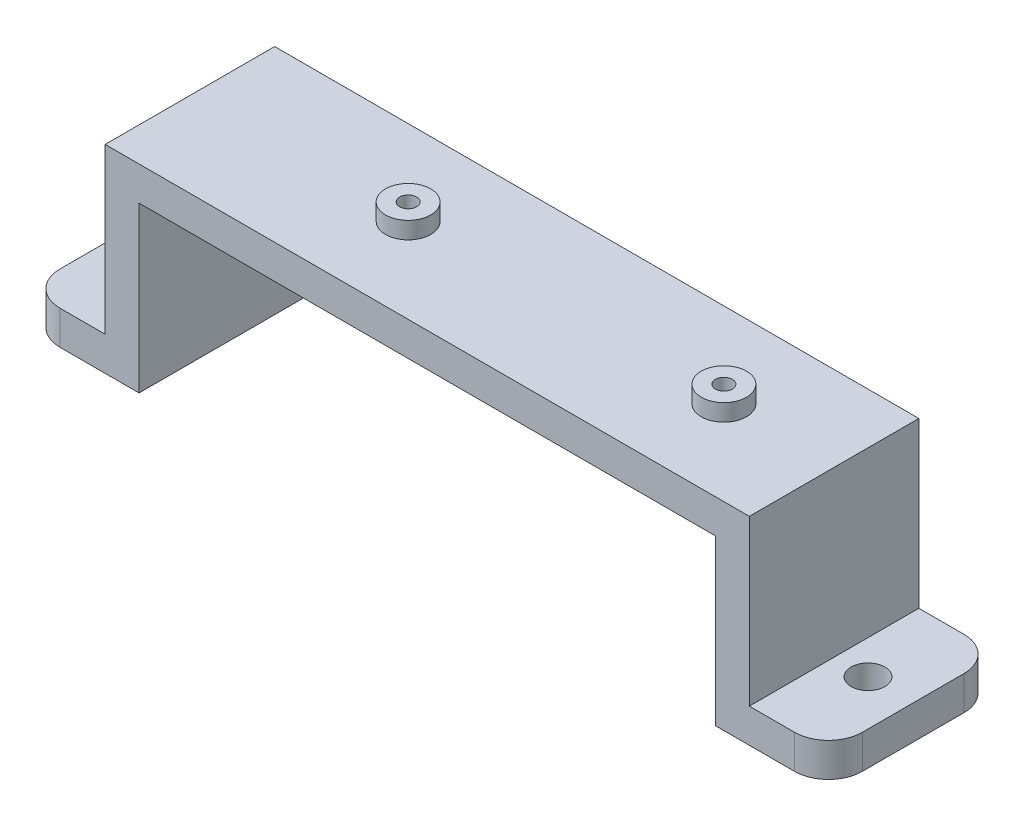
SolidWorks part; units mm, degrees
ref_plane "Plan de face" through (0, 0, 0) normal (0, 0, 1) x (1, 0, 0)
ref_plane "Plan de dessus" through (0, 0, 0) normal (0, 1, 0) x (1, 0, 0)
ref_plane "Plan de droite" through (0, 0, 0) normal (1, 0, 0) x (0, 0, -1)
sketch "Esquisse1" plane through (0, 0, 0) normal (0, 0, 1) x (1, 0, 0)
  line L0 (-35.5, 0) -> (-25.5, 0)
  line L1 (-25.5, 0) -> (-25.5, 14.5476)
  line L2 (-25.5, 14.5476) -> (25.5, 14.5476)
  line L3 (25.5, 14.5476) -> (25.5, 0)
  line L4 (25.5, 0) -> (35.5, 0)
  line L5 (0, 14.5476) -> (0, -4.7677) construction
  line L6 (-35.5, 3) -> (-28.5, 3)
  line L7 (-28.5, 3) -> (-28.5, 17.5476)
  line L8 (-28.5, 17.5476) -> (28.5, 17.5476)
  line L9 (28.5, 17.5476) -> (28.5, 3)
  line L10 (28.5, 3) -> (35.5, 3)
  line L11 (35.5, 3) -> (35.5, 0)
  line L12 (-35.5, 0) -> (-35.5, 3)
  dimension "D1" = 51
  dimension "D2" = 10
  dimension "D3" = 10
  dimension "D4" = 3
extrude "Extrusion1" add sketch "Esquisse1" along normal blind 15
sketch "Esquisse2" plane through (0, 17.5476, 0) normal (0, 1, 0) x (-1, 0, 0)
  line L0 (-28.5, 7.5) -> (28.5, 7.5) construction
  line L1 (-28.5, 15) -> (-28.5, 0) construction
  line L2 (28.5, 15) -> (28.5, 0) construction
  circle A0 centre (9.19, 7.5) radius 0.75
  circle A1 centre (-18.75, 7.5) radius 0.75
  dimension "D2" = 27.94
  dimension "D1" = 9.75
  dimension "D3" = 1.5
  dimension "D4" = 1.5
extrude "Enlèv. mat.-Extru.1" cut sketch "Esquisse2" against normal through all
fillet "Congé1" radius 3 4 edges at (35.5, 1.5, 0) (-35.5, 1.5, 0) (35.5, 1.5, 15) (-35.5, 1.5, 15)
sketch "Esquisse3" plane through (0, 0, 0) normal (0, -1, 0) x (1, 0, 0)
  line L0 (35.5, 7.5) -> (-35.5, 7.5) construction
  line L1 (35.5, 12) -> (35.5, 3) construction
  line L2 (-35.5, 12) -> (-35.5, 3) construction
  line L3 (0, 0) -> (0, 11.6453) construction
  circle A0 centre (31.5, 7.5) radius 1.5
  circle A1 centre (-31.5, 7.5) radius 1.5
  dimension "D1" = 4
extrude "Enlèv. mat.-Extru.2" cut sketch "Esquisse3" against normal through all
sketch "Esquisse4" plane through (0, 17.5476, 0) normal (0, 1, 0) x (-1, 0, 0)
  circle A0 centre (-18.75, 7.5) radius 0.75
  circle A1 centre (-18.75, 7.5) radius 2
  circle A2 centre (9.19, 7.5) radius 0.75
  circle A3 centre (9.19, 7.5) radius 2
extrude "Extrusion2" add sketch "Esquisse4" along normal blind 1.5
